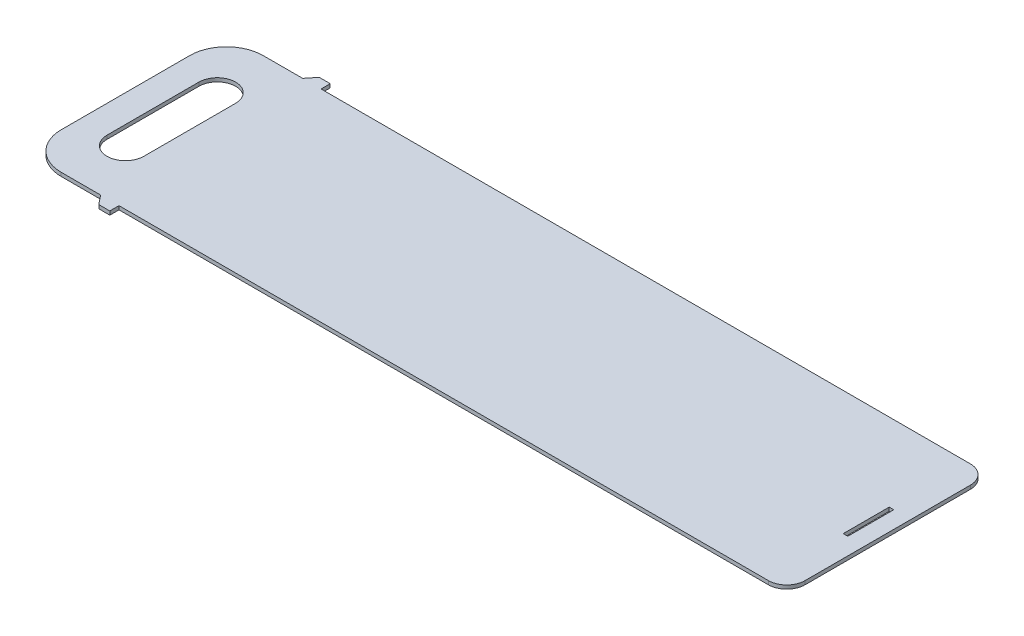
SolidWorks part; units mm, degrees
ref_plane "Ön Düzlem" through (0, 0, 0) normal (0, 0, 1) x (1, 0, 0)
ref_plane "Üst Düzlem" through (0, 0, 0) normal (0, 1, 0) x (1, 0, 0)
ref_plane "Sağ Düzlem" through (0, 0, 0) normal (1, 0, 0) x (0, 0, -1)
sketch "Çizim1" plane through (0, 0, 0) normal (0, 1, 0) x (1, 0, 0)
  line L1 (0, 0) -> (415, 0)
  line L2 (0, 0) -> (0, 110)
  line L3 (0, 110) -> (415, 110)
  line L4 (415, 0) -> (415, 110)
  dimension "D1" = 415
  dimension "D2" = 110
base flange "Taban-Flanş1" sketch "Çizim1" thickness 2 reverse thickness direction no parameters "D1"=0.7432
fillet "Radyus1" radius 10 2 edges at (415, -1, -110) (415, -1, 0)
sketch "Çizim6" plane through (0, 0, 0) normal (0, 1, 0) x (1, 0, 0)
  line L0 (415, 55) -> (0, 55) construction
  line L1 (415, 0) -> (415, 110) construction
  line L2 (0, 110) -> (0, 0) construction
  line L3 (415, 10) -> (415, 100) construction
  line L4 (405.75, 67.5) -> (403.25, 67.5)
  line L5 (405.75, 67.5) -> (405.75, 42.5)
  line L6 (405.75, 42.5) -> (403.25, 42.5)
  line L7 (403.25, 67.5) -> (403.25, 42.5)
  line L32 (51.25, 110) -> (51.25, 0) construction
  line L33 (405, 110) -> (0, 110) construction
  line L34 (0, 0) -> (405, 0) construction
  point P10 (404.5, 42.5)
  dimension "D1" = 25
  dimension "D2" = 2.5
  dimension "D3" = 10.5
  dimension "D10" = 352
extrude "Kes-Ekstrüzyon1" cut sketch "Çizim6" against normal blind 10
sketch "Çizim19" plane through (0, 0, 0) normal (0, 1, 0) x (1, 0, 0)
  line L0 (403.25, 55) -> (51.5, 55) construction
  line L1 (403.25, 67.5) -> (403.25, 42.5) construction
  line L2 (51.5, 0) -> (51.5, 110) construction
  line L3 (405, 110) -> (0, 110) construction
  line L4 (415, 10) -> (415, 100) construction
  line L6 (51.5, 0) -> (51.5, -5)
  line L7 (51.5, -5) -> (45.5, -5)
  line L8 (45.5, -5) -> (41.5, 0)
  line L9 (0, 0) -> (405, 0) construction
  line L10 (41.5, 0) -> (51.5, 0)
  line L11 (45.5, 115) -> (41.5, 110)
  line L12 (51.5, 115) -> (45.5, 115)
  line L13 (51.5, 110) -> (51.5, 115)
  line L14 (41.5, 110) -> (51.5, 110)
  point P9 (51.5, 55)
  dimension "D1" = 363.5
  dimension "D2" = 5
  dimension "D3" = 10
  dimension "D4" = 6
base flange "Sekme4" sketch "Çizim19" thickness 2 reverse thickness direction no parameters "D1"=0.7432
fillet "Radyus4" radius 20 2 edges at (0, -1, -110) (0, -1, 0)
sketch "Çizim22" plane through (0, 0, 0) normal (0, 1, 0) x (1, 0, 0)
  line L0 (25, 80) -> (25, 30) construction
  line L1 (35, 80) -> (35, 30)
  line L2 (15, 80) -> (15, 30)
  line L3 (0, 90) -> (0, 20) construction
  line L4 (0, 55) -> (25, 55) construction
  arc A0 (35, 80) -> (15, 80) centre (25, 80) ccw
  arc A1 (15, 30) -> (35, 30) centre (25, 30) ccw
  point P2 (25, 55)
  dimension "D2" = 10
  dimension "D1" = 25
  dimension "D3" = 50
extrude "Kes-Ekstrüzyon6" cut sketch "Çizim22" against normal blind 10
sketch "Büküm-Çizgileri1" [suppressed] plane through (0, 0, 0) normal (0, 1, 0) x (1, 0, 0)
sketch "Sınırlandırma-Kutusu1" [suppressed] plane through (0, 0, 0) normal (0, 1, 0) x (1, 0, 0)
sheet metal parameters "Sac-Levha1" thickness 2 parameters "D1"=0.7432
flat pattern "Düz-Çoğaltma1"
sketch "Büküm-Çizgileri2" plane through (0, 0, 0) normal (0, 1, 0) x (1, 0, 0)
sketch3d "Sınırlandırma-Kutusu2" [suppressed]
  line L0 (0, 70, 0) -> (400, 70, 0) construction
  line L1 (0, 0, 0) -> (400, 0, 0) construction
  line L2 (0, 70, 0) -> (0, 0, 0) construction
  line L3 (400, 70, 0) -> (400, 0, 0) construction
sheet metal parameters "Sac-Levha2" thickness 2 parameters "D1"=0.7432
flat pattern "Düz-Çoğaltma1"
sketch "Büküm-Çizgileri2" plane through (0, 0, 0) normal (0, 1, 0) x (1, 0, 0)
sketch3d "Sınırlandırma-Kutusu2" [suppressed]
  line L0 (0, 110, 0) -> (415, 110, 0) construction
  line L1 (0, 0, 0) -> (415, 0, 0) construction
  line L2 (0, 110, 0) -> (0, 0, 0) construction
  line L3 (415, 110, 0) -> (415, 0, 0) construction
sheet metal parameters "Sac-Levha10" thickness 2 parameters "D1"=0.7432
flat pattern "Düz-Çoğaltma10"
sketch "Büküm-Çizgileri6" plane through (0, 0, 0) normal (0, 1, 0) x (1, 0, 0)
sketch3d "Sınırlandırma-Kutusu6" [suppressed]
  line L0 (0, 115, 0) -> (415, 115, 0) construction
  line L1 (0, -5, 0) -> (415, -5, 0) construction
  line L2 (0, 115, 0) -> (0, -5, 0) construction
  line L3 (415, 115, 0) -> (415, -5, 0) construction
sheet metal parameters "Sac-Levha11" thickness 2 parameters "D1"=0.7432
flat pattern "Düz-Çoğaltma10"
sketch "Büküm-Çizgileri6" plane through (0, 0, 0) normal (0, 1, 0) x (1, 0, 0)
sketch3d "Sınırlandırma-Kutusu6" [suppressed]
  line L0 (0, 115, 0) -> (415, 115, 0) construction
  line L1 (0, -5, 0) -> (415, -5, 0) construction
  line L2 (0, 115, 0) -> (0, -5, 0) construction
  line L3 (415, 115, 0) -> (415, -5, 0) construction
